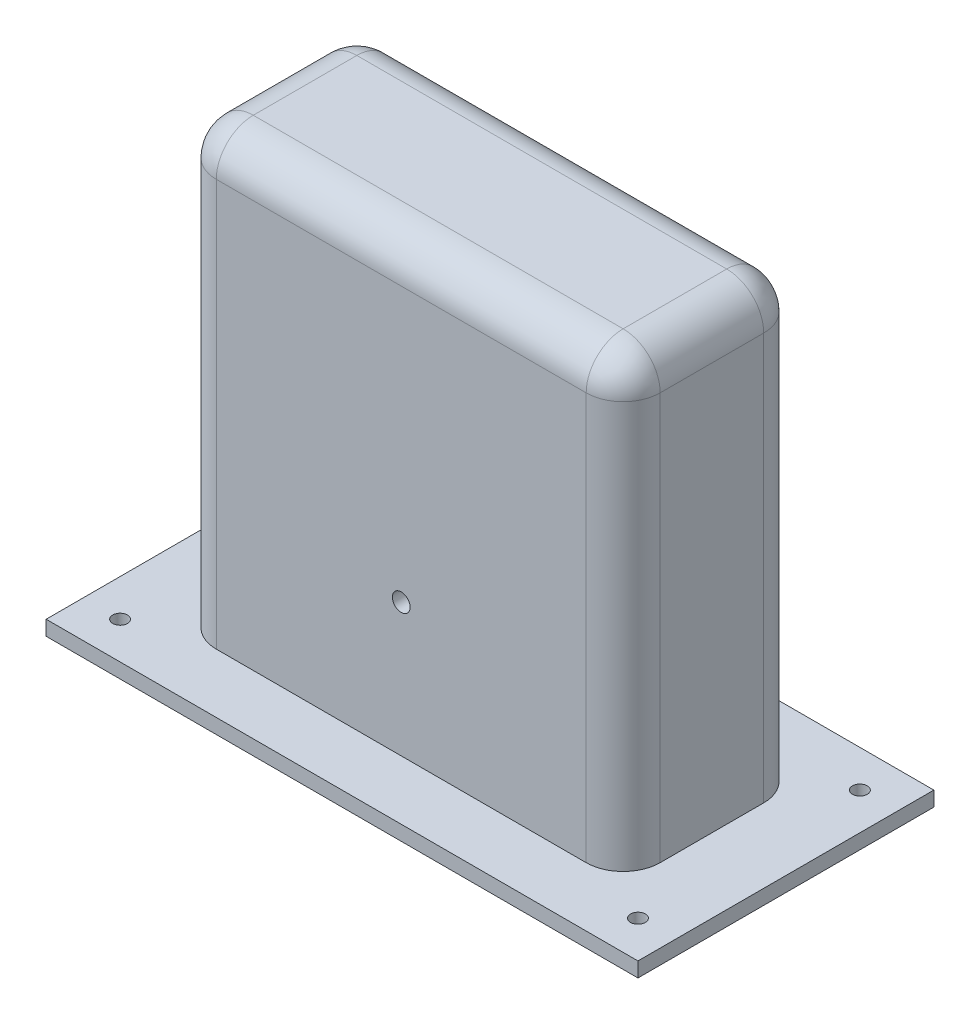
SolidWorks part; units mm, degrees
ref_plane "Plan de face" through (0, 0, 0) normal (0, 0, 1) x (1, 0, 0)
ref_plane "Plan de dessus" through (0, 0, 0) normal (0, 1, 0) x (1, 0, 0)
ref_plane "Plan de droite" through (0, 0, 0) normal (1, 0, 0) x (0, 0, -1)
sketch "Esquisse1" plane through (0, 0, 0) normal (0, 1, 0) x (1, 0, 0)
  line L1 (-200, 100) -> (200, 100)
  line L2 (-200, 100) -> (-200, -100)
  line L3 (-200, -100) -> (200, -100)
  line L4 (200, 100) -> (200, -100)
  line L5 (-200, 100) -> (200, -100) construction
  line L6 (-200, -100) -> (200, 100) construction
  line L7 (-175, 75) -> (175, 75) construction
  line L8 (-175, 75) -> (-175, -75) construction
  line L9 (-175, -75) -> (175, -75) construction
  line L10 (175, 75) -> (175, -75) construction
  line L11 (-175, 75) -> (175, -75) construction
  line L12 (-175, -75) -> (175, 75) construction
  circle A0 centre (175, 75) radius 5
  circle A1 centre (175, -75) radius 5
  circle A2 centre (-175, 75) radius 5
  circle A3 centre (-175, -75) radius 5
  point P0 (0, 0)
  point P6 (0, 0)
  dimension "D5" = 10
  dimension "D1" = 400
  dimension "D2" = 200
  dimension "D3" = 25
  dimension "D4" = 25
extrude "Boss.-Extru.1" add sketch "Esquisse1" along normal blind 10
sketch "Esquisse2" plane through (0, 10, 0) normal (0, 1, 0) x (1, 0, 0)
  line L1 (-150, 60) -> (150, 60)
  line L2 (-150, 60) -> (-150, -60)
  line L3 (-150, -60) -> (150, -60)
  line L4 (150, 60) -> (150, -60)
  line L5 (-150, 60) -> (150, -60) construction
  line L6 (-150, -60) -> (150, 60) construction
  point P0 (0, 0)
  dimension "D1" = 300
  dimension "D2" = 120
extrude "Boss.-Extru.2" add sketch "Esquisse2" along normal blind 300
shell "Coque2" thickness 10
fillet "Congé1" radius 25 16 edges at (0, 310, -60) (-150, 310, 0) (-150, 160, -60) (0, 310, 60) (150, 310, 0) (150, 160, -60) (150, 160, 60) (-150, 160, 60) (0, 300, -50) (-140, 300, 0) (0, 300, 50) (140, 300, 0) (140, 155, 50) (140, 155, -50) (-140, 155, -50) (-140, 155, 50)
sketch "Esquisse3" plane through (0, 0, -60) normal (0, 0, -1) x (-1, 0, 0)
  line L0 (0, 0) -> (0, 319.4363) construction
  circle A0 centre (0, 100) radius 6
  dimension "D1" = 12
  dimension "D2" = 100
extrude "Enlèv. mat.-Extru.1" cut sketch "Esquisse3" against normal through all
